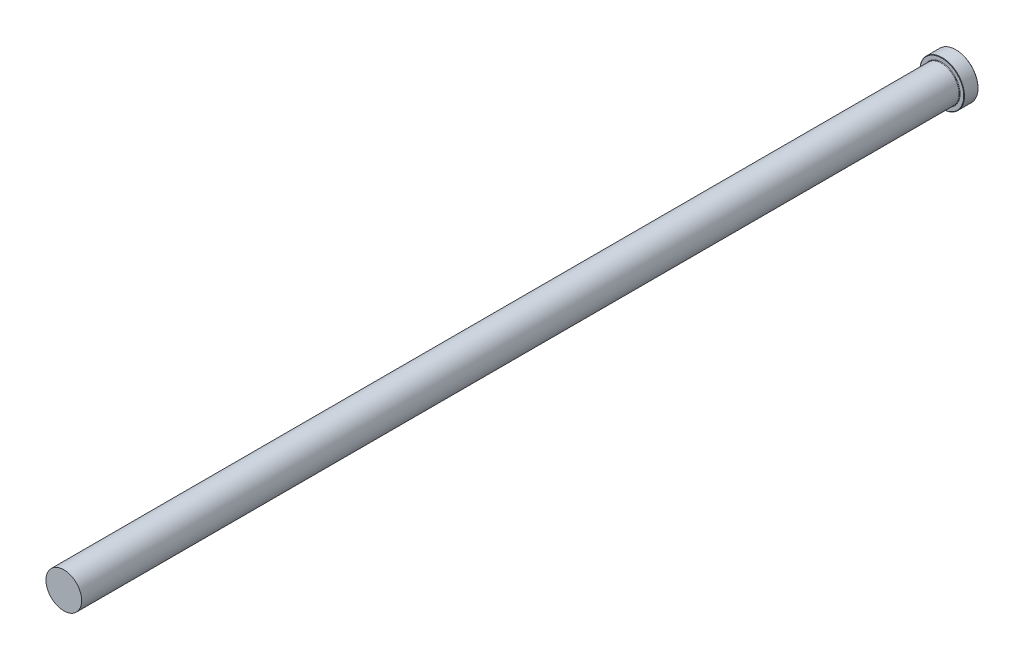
SolidWorks part; units mm, degrees
ref_plane "Front Plane" through (0, 0, 0) normal (0, 0, 1) x (1, 0, 0)
ref_plane "Top Plane" through (0, 0, 0) normal (0, 1, 0) x (1, 0, 0)
ref_plane "Right Plane" through (0, 0, 0) normal (1, 0, 0) x (0, 0, -1)
sketch "Sketch1" plane through (0, 0, 0) normal (1, 0, 0) x (0, 0, -1)
  line L0 (0, 0) -> (0, 12.5)
  line L1 (0, 12.65) -> (0, -12.65) construction
  line L2 (0, 12.5) -> (-8, 12.5)
  line L3 (-8, 12.5) -> (-8, 10.3)
  line L4 (-8.3, 10) -> (-500, 10)
  line L5 (-500, 10) -> (-500, 0)
  line L6 (12.65, 0) -> (-12.65, 0) construction
  line L7 (-500, 0) -> (0, 0)
  line L8 (-109.0506, 0) -> (16.9928, 0) construction
  arc A0 (-8, 10.3) -> (-8.3, 10) centre (-8.3, 10.3) cw
  dimension "D1" = 0.3
  dimension "D2" = 25
  dimension "D3" = 20
  dimension "D4" = 500
  dimension "D5" = 8
revolve "Revolve1" add sketch "Sketch1" angle 360 about L8
chamfer "Chamfer1" distance 0.2 angle 45 2 edges at (12.5, 0, 0) (12.5, 0, 8)
